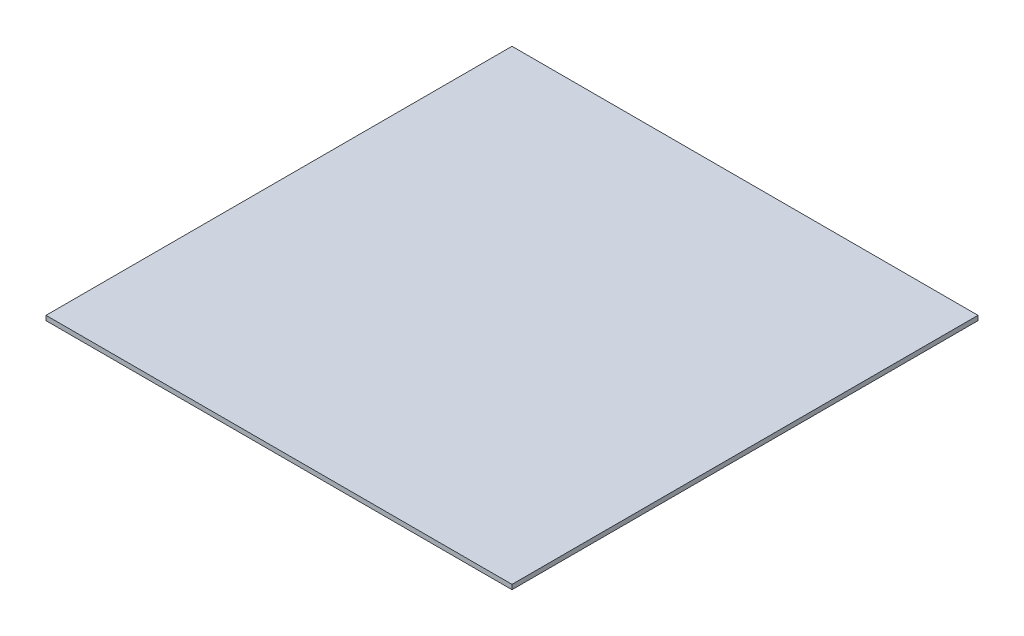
SolidWorks part; units mm, degrees
ref_plane "Front Plane" through (0, 0, 0) normal (0, 0, 1) x (1, 0, 0)
ref_plane "Top Plane" through (0, 0, 0) normal (0, 1, 0) x (1, 0, 0)
ref_plane "Right Plane" through (0, 0, 0) normal (1, 0, 0) x (0, 0, -1)
sketch "Sketch1" plane through (0, 0, 0) normal (0, 1, 0) x (1, 0, 0)
  line L1 (2500, -2500) -> (-2500, -2500)
  line L2 (2500, -2500) -> (2500, 2500)
  line L3 (2500, 2500) -> (-2500, 2500)
  line L4 (-2500, -2500) -> (-2500, 2500)
  line L5 (2500, -2500) -> (-2500, 2500) construction
  line L6 (2500, 2500) -> (-2500, -2500) construction
  point P0 (0, 0)
  dimension "D1" = 5000
  dimension "D2" = 5000
extrude "Boss-Extrude1" add sketch "Sketch1" along normal blind 50
